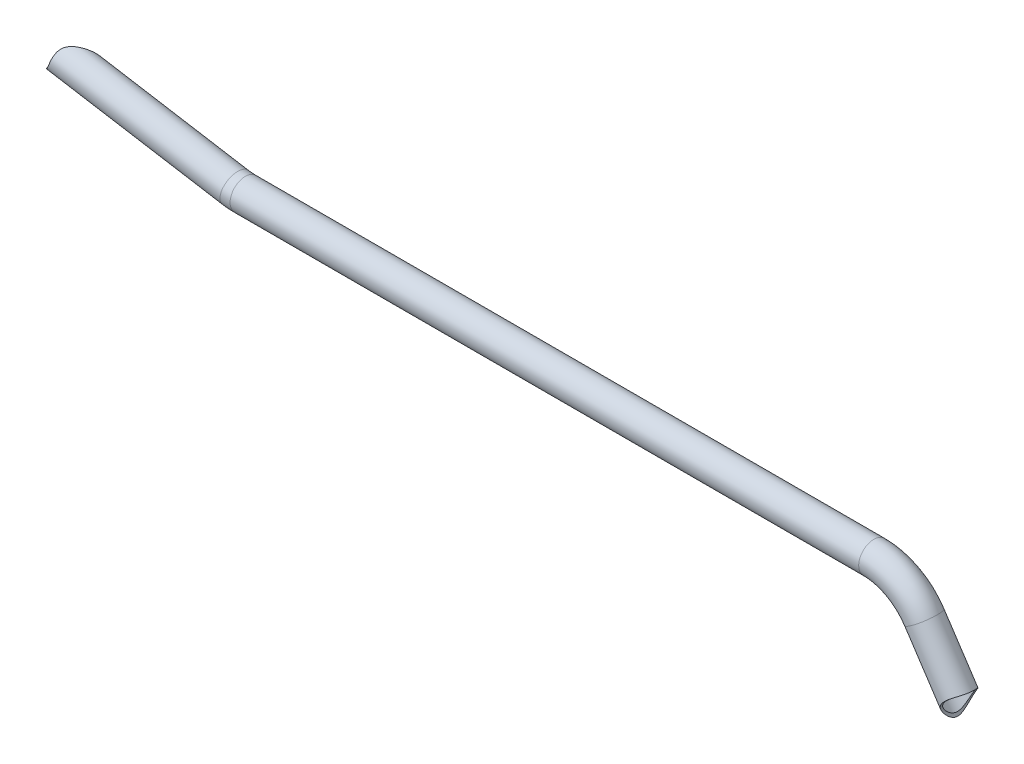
SolidWorks part; units mm, degrees
ref_plane "Face" through (0, 0, 0) normal (0, 0, 1) x (1, 0, 0)
ref_plane "Dessus" through (0, 0, 0) normal (0, 1, 0) x (1, 0, 0)
ref_plane "Droite" through (0, 0, 0) normal (1, 0, 0) x (0, 0, -1)
sketch "Esquisse1" plane through (0, 0, 0) normal (0, 0, 1) x (1, 0, 0)
  line L0 (-275.0342, 95) -> (347.7474, 95)
  line L1 (442.8318, 0) -> (397.7921, 68.0989)
  line L3 (-284.8982, 95.8164) -> (-460, 125)
  line L4 (442.8318, 0) -> (0, 0) construction
  arc A0 (397.7921, 68.0989) -> (347.7474, 95) centre (347.7474, 35) ccw
  arc A1 (-275.0342, 95) -> (-284.8982, 95.8164) centre (-275.0342, 155) cw
  point P12 (380, 95)
  point P15 (-280, 95)
  dimension "D5" = 60
  dimension "D6" = 60
  dimension "D1" = 280
  dimension "D2" = 380
  dimension "D3" = 180
  dimension "D4" = 125
  dimension "D7" = 95
ref_plane "Plan1" through (-460, 125, 0) normal (-0.9864, 0.1644, 0) x (0, 0, 1)
sketch "Esquisse2" plane through (-460, 125, 0) normal (-0.9864, 0.1644, 0) x (0, 0, 1)
  circle A0 centre (0, 0) radius 15
  circle A1 centre (0, 0) radius 13
  dimension "D1" = 30
  dimension "D2" = 26
sweep "Balayage1" add profiles "Esquisse2" path "Esquisse1"
sketch "Esquisse3" plane through (0, 0, 0) normal (0, 1, 0) x (-1, 0, 0)
  line L1 (-426.2154, 171.9786) -> (-463.1361, -32.3926) construction
  line L2 (-437.6652, -60.151) -> (-415.9763, 59.9056) construction
  line L3 (-437.6652, -60.151) -> (-415.9763, 59.9056)
  line L4 (-426.2154, 171.9786) -> (-473.9512, -92.258) construction
  line L5 (-496.7095, -49.4843) -> (-437.6652, -60.151) construction
  line L6 (-467.1874, -54.8177) -> (-437.6652, -60.151)
  line L7 (-415.9763, 59.9056) -> (-445.4985, 65.2389)
  line L8 (-467.1874, -54.8177) -> (-445.4985, 65.2389)
revolve "Enlèvement de matière-Révolution1" cut sketch "Esquisse3" angle 360 about L4
sketch "Esquisse4" plane through (24.3152, 3.2825, -27.9414) normal (0.6539, 0.0883, -0.7514) x (-0.7564, 0.0534, -0.6519)
  circle A0 centre (355.0908, 136.5572) radius 15
  circle A1 centre (355.0908, 136.5572) radius 15 construction
extrude "Enlèv. mat.-Extru.1" cut sketch "Esquisse4" against normal through all
sketch "Esquisse5" plane through (-460, 125, 0) normal (-0.9864, 0.1644, 0) x (0, 0, 1)
  circle A0 centre (0, 0) radius 15
  circle A1 centre (0, 0) radius 13
  dimension "D1" = 26
  dimension "D2" = 30
extrude "Extrusion1" [suppressed] add sketch "Esquisse5" against normal blind 40
